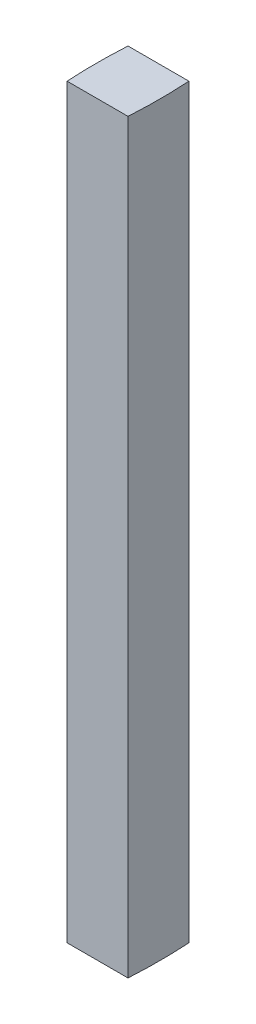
SolidWorks part; units mm, degrees
ref_plane "Płaszczyzna przednia" through (0, 0, 0) normal (0, 0, 1) x (1, 0, 0)
ref_plane "Płaszczyzna górna" through (0, 0, 0) normal (0, 1, 0) x (1, 0, 0)
ref_plane "Płaszczyzna prawa" through (0, 0, 0) normal (1, 0, 0) x (0, 0, -1)
sketch "Szkic1" plane through (0, 0, 0) normal (0, 1, 0) x (1, 0, 0)
  line L1 (-19.5496, 15) -> (10.4504, 15)
  line L3 (-19.5496, -15) -> (10.4504, -15)
  arc A0 (-19.5496, 15) -> (-19.5496, -15) centre (230, 0) ccw
  arc A3 (10.4504, -15) -> (10.4504, 15) centre (-230, 0) ccw
  point P0 (0, 0)
  dimension "D3" = 500
  dimension "D1" = 230
  dimension "D2" = 30
  dimension "D5" = 230
extrude "Dodanie-wyciągnięcie1" add sketch "Szkic1" along normal blind 367.5
